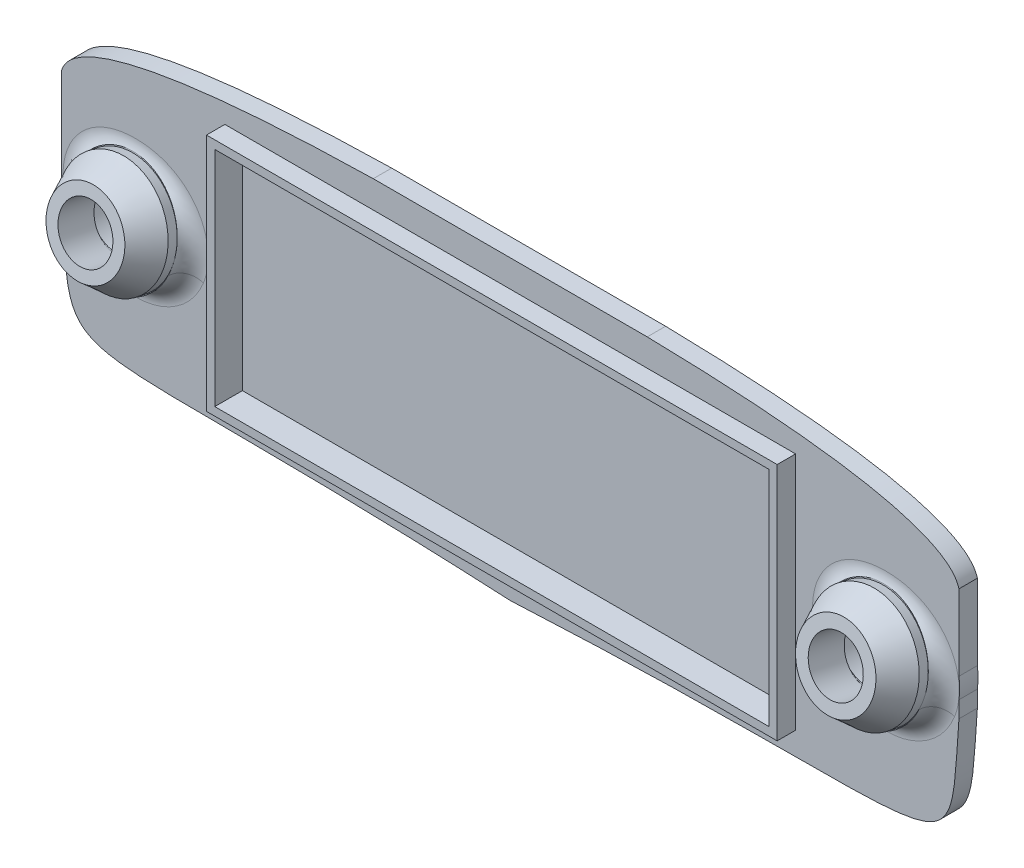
SolidWorks part; units mm, degrees
ref_plane "Alzado" through (0, 0, 0) normal (0, 0, 1) x (1, 0, 0)
ref_plane "Planta" through (0, 0, 0) normal (0, 1, 0) x (1, 0, 0)
ref_plane "Vista lateral" through (0, 0, 0) normal (1, 0, 0) x (0, 0, -1)
sketch "Croquis1" plane through (0, 0, 0) normal (0, 0, 1) x (1, 0, 0)
  line L1 (0, 0) -> (97.5, 0)
  line L2 (0, 0) -> (0, 32.25)
  line L3 (0, 32.25) -> (97.5, 32.25)
  line L4 (97.5, 0) -> (97.5, 32.25)
  dimension "D1" = 97.5
  dimension "D2" = 32.25
extrude "Saliente-Extruir1" add sketch "Croquis1" along normal blind 2
sketch "Croquis3" plane through (0, 0, 2) normal (0, 0, 1) x (1, 0, 0)
  line L0 (150.6815, -11.5799) -> (150.6815, 154.6798) construction
  line L1 (48.75, 0) -> (48.75, 48.4691) construction
  line L2 (0, 0) -> (97.5, 0) construction
  line L3 (48.75, 48.4691) -> (48.75, -20.0981) construction
  line L4 (0, 32.25) -> (0, 0) construction
  line L5 (0, 25.4778) -> (0, 13.2533)
  line L6 (97.5, 25.4778) -> (97.5, 13.2533)
  circle A0 centre (8.0518, 16.1458) radius 5.9768
  circle A1 centre (89.5658, 16.1458) radius 5.9768
  spline S0 degree 3 poles (0, 25.4778) (1.4003, 30.6605) (20.1598, 32.7309) (48.75, 32.25) knots 0 0 0 0 1 1 1 1
  spline S1 degree 3 poles (0, 13.2533) (1.2772, -3.7542) (-1.8304, 2.6183) (48.75, 0) knots 0 0 0 0 1 1 1 1
  spline S2 degree 3 poles (97.5, 25.4778) (96.0997, 30.6605) (77.3402, 32.7309) (48.75, 32.25) knots 0 0 0 0 1 1 1 1
  spline S3 degree 3 poles (97.5, 13.2533) (96.2228, -3.7542) (99.3304, 2.6183) (48.75, 0) knots 0 0 0 0 1 1 1 1
  point P18 (88.1628, 16.1458)
  point P19 (89.5658, 16.1458)
extrude "Cortar-Extruir4" cut sketch "Croquis3" against normal blind 2 flip side to cut
sketch "Croquis5" plane through (0, 0, 2) normal (0, 0, 1) x (1, 0, 0)
  circle A0 centre (8.0518, 16.1458) radius 5.9285
  circle A1 centre (89.5658, 16.1458) radius 6.0127
  circle A2 centre (8.0518, 16.1458) radius 2.8696
  circle A3 centre (89.5658, 16.1458) radius 2.8696
extrude "Saliente-Extruir2" add sketch "Croquis5" along normal blind 5
sketch "Croquis11" plane through (0, 0, 0) normal (1, 0, 0) x (0, 0, -1)
  line L0 (-2.1152, 22.937) -> (-7.2125, 22.937)
  line L1 (-7.2125, 22.937) -> (-7.2125, -1.3782)
  line L2 (-7.2125, -1.3782) -> (-2.1152, 22.937)
  point P3 (0, 0)
  point P4 (-3.3684, 22.6285)
  point P5 (-2.3678, 22.7864)
  point P6 (-3.6768, 22.937)
extrude "Cortar-Extruir10" cut sketch "Croquis11" along normal through all
sketch "Croquis7" plane through (0, 0, 0) normal (0, 0, -1) x (-1, 0, 0)
  circle A0 centre (-89.5658, 16.1458) radius 8.0107
  circle A1 centre (-89.5658, 16.1458) radius 4.5
  circle A2 centre (-8.0518, 16.1458) radius 4.5
  circle A3 centre (-8.0518, 16.1458) radius 8.0107
extrude "Saliente-Extruir3" add sketch "Croquis7" against normal blind 2
sketch "Croquis10" plane through (0, 0, 0) normal (0, 0, -1) x (-1, 0, 0)
  circle A0 centre (-89.5658, 16.1458) radius 4.5
  circle A1 centre (-8.0518, 16.1458) radius 4.5
extrude "Cortar-Extruir9" cut sketch "Croquis10" against normal blind 4
sketch "Croquis8" plane through (0, 0, 2) normal (0, 0, 1) x (1, 0, 0)
  line L0 (48.75, 32.25) -> (48.75, 26.3481) construction
  line L1 (17.75, 29.2991) -> (79.75, 29.2991)
  line L2 (17.75, 29.2991) -> (17.75, 3.2991)
  line L3 (17.75, 3.2991) -> (79.75, 3.2991)
  line L4 (79.75, 29.2991) -> (79.75, 3.2991)
  line L5 (63.6314, 32.25) -> (33.8686, 32.25) construction
  point P6 (48.75, 29.2991)
  dimension "D1" = 26
  dimension "D2" = 62
extrude "Saliente-Extruir4" add sketch "Croquis8" along normal blind 2
sketch "Croquis9" plane through (0, 0, 4) normal (0, 0, 1) x (1, 0, 0)
  line L0 (17.75, 29.2991) -> (17.75, 3.2991) construction
  line L1 (18.65, 28.3991) -> (78.85, 28.3991)
  line L2 (18.65, 28.3991) -> (18.65, 4.1991)
  line L3 (18.65, 4.1991) -> (78.85, 4.1991)
  line L4 (78.85, 28.3991) -> (78.85, 4.1991)
  line L5 (79.75, 29.2991) -> (17.75, 29.2991) construction
  line L6 (17.75, 3.2991) -> (79.75, 3.2991) construction
  line L7 (79.75, 3.2991) -> (79.75, 29.2991) construction
  dimension "D1" = 0.9
  dimension "D2" = 0.9
  dimension "D3" = 0.9
  dimension "D4" = 0.9
sketch "Croquis12" plane through (0, 1.3903, 6.6321) normal (0, 0.2052, 0.9787) x (1, 0, 0)
  circle A0 centre (8.0518, 15.0762) radius 2.9247
  circle A1 centre (8.0518, 15.0762) radius 5.9285
  circle A2 centre (89.5658, 15.0762) radius 2.932
  circle A3 centre (89.5658, 15.0762) radius 6.0127
extrude "Saliente-Extruir5" add sketch "Croquis12" along normal blind 4
extrude "Cortar-Extruir11" cut sketch "Croquis9" against normal blind 3 contours L2 L3 L4 L1
fillet "Redondeo6" radius 2 2 edges at (2.1232, 16.1458, 2) (83.5531, 16.1458, 2)
chamfer "Chaflán2" distance 3 angle 30 2 edges at (89.5658, 11.0817, 8.6875) (8.0518, 11.164, 8.6702)
